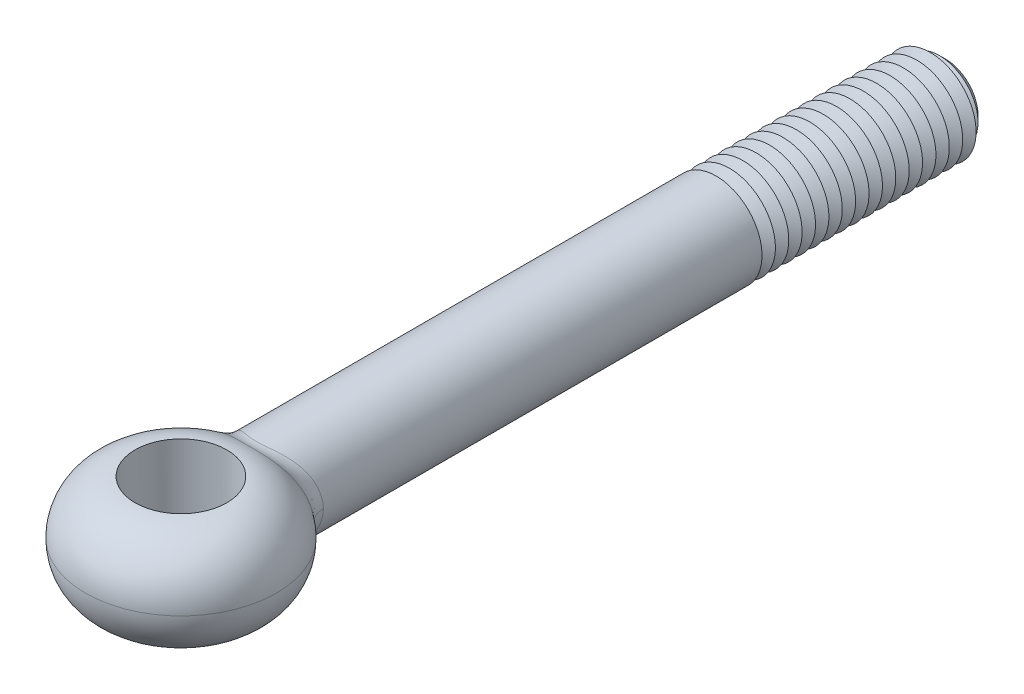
SolidWorks part; units mm, degrees
ref_plane "Front Plane" through (0, 0, 0) normal (0, 0, 1) x (1, 0, 0)
ref_plane "Top Plane" through (0, 0, 0) normal (0, 1, 0) x (1, 0, 0)
ref_plane "Right Plane" through (0, 0, 0) normal (1, 0, 0) x (0, 0, -1)
sketch "Sketch7" plane through (0, 0, 0) normal (0, 1, 0) x (1, 0, 0)
  circle A0 centre (0, 0) radius 12.5
  dimension "D1" = 25
extrude "Boss-Extrude3" add sketch "Sketch7" along normal mid plane 14
sketch "Sketch8" plane through (0, 0, 0) normal (0, 0, 1) x (1, 0, 0)
  circle A0 centre (0, 0) radius 6
  dimension "D1" = 12
extrude "Boss-Extrude4" add sketch "Sketch8" against normal blind 100
fillet "Fillet5" radius 7 2 edges at (0, -7, 12.5) (0, 7, 12.5)
fillet "Fillet6" radius 3 2 edges at (0.1735, -5.9975, -9.1081) (-0.1735, 5.9975, -9.1081)
chamfer "Chamfer1" distance 1.75 angle 45 1 edges at (6, 0, -100)
sketch "Sketch10" plane through (0, 0, 0) normal (0, 1, 0) x (1, 0, 0)
  line L0 (0, 28.1405) -> (0, -7.9233) construction
sketch "Sketch11" plane through (0, 0, 0) normal (0, 1, 0) x (1, 0, 0)
  line L0 (-6, 70) -> (-4.4845, 70.875)
  line L1 (-6, 98.25) -> (-6, 12.6194) construction
  line L2 (-4.4845, 70.875) -> (-6, 71.75)
  line L3 (-6, 71.75) -> (-6, 70)
  line L4 (4.25, 100) -> (-4.25, 100) construction
  dimension "D1" = 1.75
  dimension "D2" = 30
revolve "Cut-Revolve1" cut sketch "Sketch11" angle 360 about L0
pattern_linear "LPattern1" count 17 spacing 1.75 along (0, 0, -1) of "Cut-Revolve1"
sketch "Sketch12" plane through (0, 0, 0) normal (0, 1, 0) x (1, 0, 0)
  circle A0 centre (0, 0) radius 6
  dimension "D1" = 12
extrude "Cut-Extrude1" cut sketch "Sketch12" against normal mid plane 14
